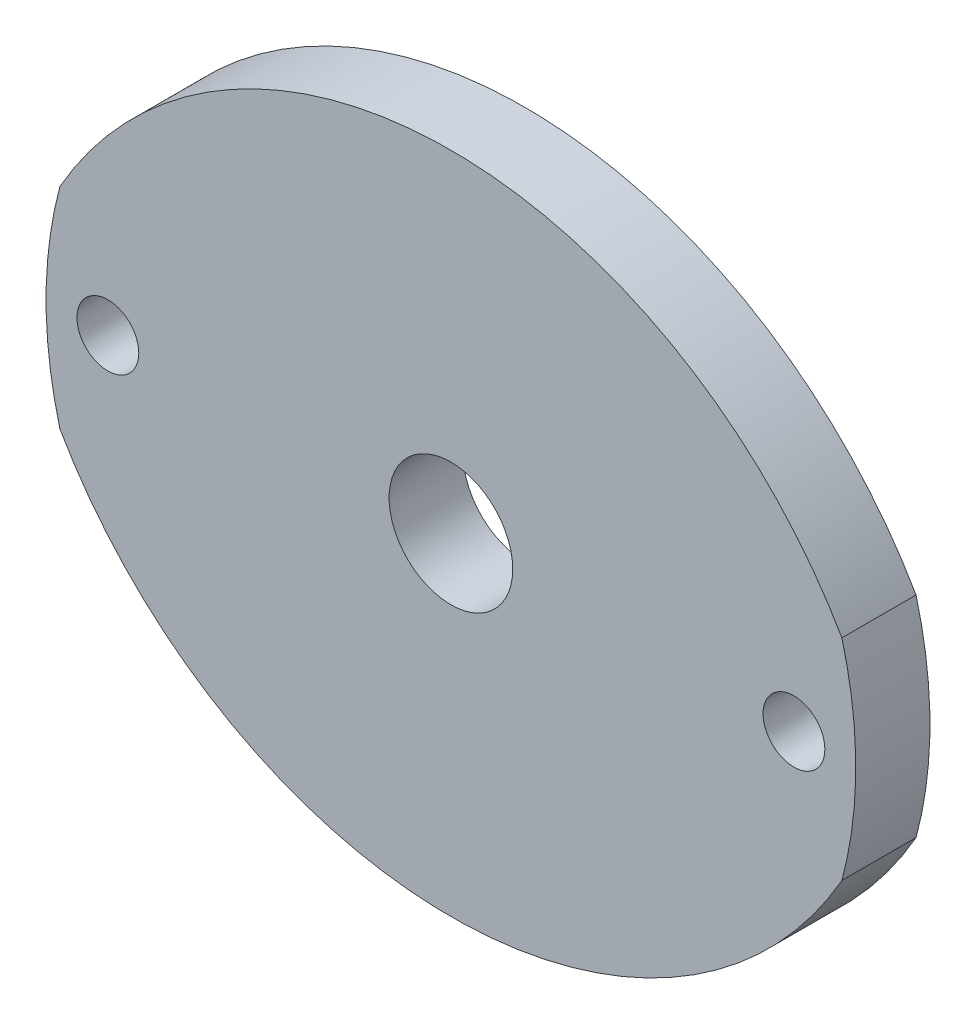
SolidWorks part; units mm, degrees
ref_plane "Front Plane" through (0, 0, 0) normal (0, 0, 1) x (1, 0, 0)
ref_plane "Top Plane" through (0, 0, 0) normal (0, 1, 0) x (1, 0, 0)
ref_plane "Right Plane" through (0, 0, 0) normal (1, 0, 0) x (0, 0, -1)
sketch "Sketch3" plane through (0, 0, 0) normal (0, 0, 1) x (1, 0, 0)
  circle A4 centre (11.2572, 305.8732) radius 2.5
  circle A13 centre (25.1322, 305.8732) radius 1.25
  circle A14 centre (-2.6178, 305.8732) radius 1.25
  arc A15 (-4.5566, 310.1233) -> (-4.5566, 301.6231) centre (11.2572, 305.8732) ccw
  arc A16 (27.0711, 301.6231) -> (27.0711, 310.1233) centre (11.2572, 305.8732) ccw
  arc A17 (27.0711, 310.1233) -> (-4.5566, 310.1233) centre (11.2572, 301.0824) ccw
  arc A18 (-4.5566, 301.6231) -> (27.0711, 301.6231) centre (11.2572, 310.664) ccw
extrude "Boss-Extrude1" add sketch "Sketch3" along normal blind 3
